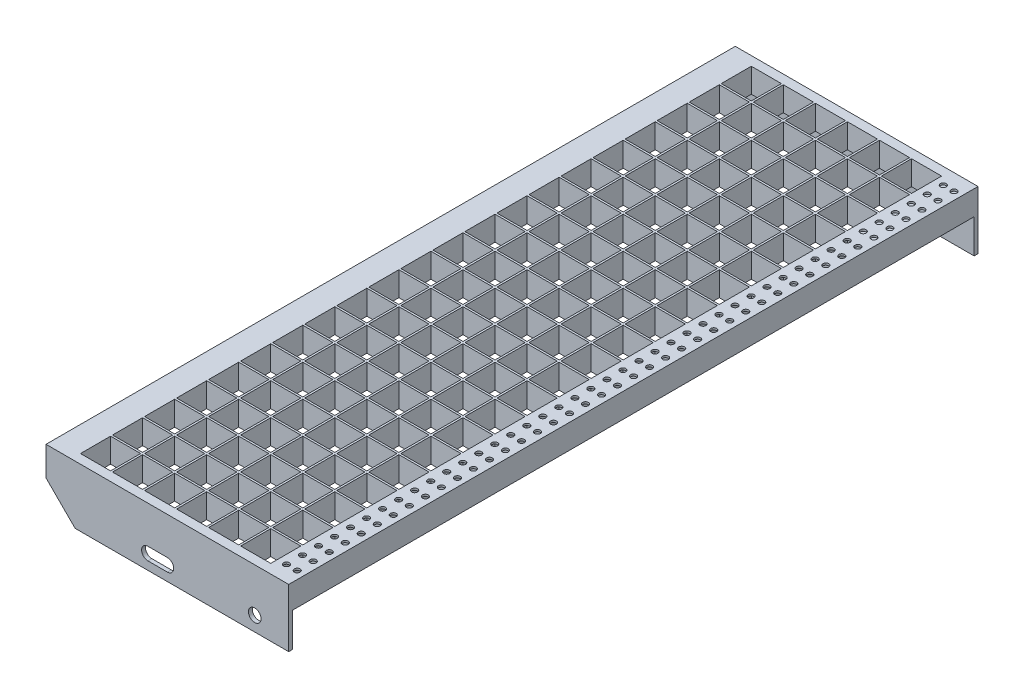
SolidWorks part; units mm, degrees
ref_plane "Vorne" through (0, 0, 0) normal (0, 0, 1) x (1, 0, 0)
ref_plane "Oben" through (0, 0, 0) normal (0, 1, 0) x (1, 0, 0)
ref_plane "Rechts" through (0, 0, 0) normal (1, 0, 0) x (0, 0, -1)
sketch "Skizze1" plane through (0, 0, 0) normal (0, 0, 1) x (1, 0, 0)
  line L1 (0, 0) -> (250, 0)
  line L2 (0, 0) -> (0, -25)
  line L3 (0, -25) -> (250, -25)
  line L4 (250, 0) -> (250, -25)
  dimension "D1" = 250
  dimension "D2" = 25
extrude "Basis-Linear austragen" add sketch "Skizze1" along normal mid plane 710
sketch "Skizze2" plane through (0, 0, 0) normal (0, 1, 0) x (-1, 0, 0)
  line L0 (-250, 355) -> (0, 355) construction
  line L1 (-222, 345.5) -> (-191, 345.5)
  line L2 (-222, 345.5) -> (-222, 314.5)
  line L3 (-222, 314.5) -> (-191, 314.5)
  line L4 (-191, 345.5) -> (-191, 314.5)
  line L5 (-250, 355) -> (-250, -355) construction
  dimension "D1" = 9.5
  dimension "D2" = 28
  dimension "D3" = 31
  dimension "D4" = 31
extrude "Schnitt-Linear austragen1" cut sketch "Skizze2" against normal through all
pattern_linear "Lineares Muster1" count 21 spacing 33 along (0, 0, -1) count 6 spacing 33 along (-1, 0, 0) of "Schnitt-Linear austragen1"
sketch "Skizze3" plane through (0, 0, 355) normal (0, 0, 1) x (1, 0, 0)
  line L0 (250, -60) -> (30, -60)
  line L1 (30, -60) -> (0, -30)
  line L2 (125, -38.5) -> (105, -38.5)
  line L3 (105, -51.5) -> (125, -51.5)
  line L4 (0, 0) -> (0, -25)
  line L5 (0, -25) -> (250, -25)
  line L6 (250, -25) -> (250, 0)
  line L7 (250, 0) -> (0, 0)
  line L8 (0, 0) -> (0, -30)
  line L10 (250, -60) -> (250, 0)
  line L11 (250, 0) -> (0, 0)
  circle A0 centre (215, -45) radius 6.5
  arc A1 (105, -38.5) -> (105, -51.5) centre (105, -45) ccw
  arc A2 (125, -51.5) -> (125, -38.5) centre (125, -45) ccw
  dimension "D5" = 13
  dimension "D2" = 60
  dimension "D3" = 30
  dimension "D4" = 30
  dimension "D6" = 13
  dimension "D7" = 90
  dimension "D8" = 20
  dimension "D9" = 35
  dimension "D10" = 15
  dimension "D1" = 0
extrude "Aufsatz-Linear austragen1" add sketch "Skizze3" against normal blind 4
mirror "Spiegeln1" about plane through (0, 0, 0) normal (0, 0, 1) of "Aufsatz-Linear austragen1"
sketch "Skizze4" plane through (0, -25, 0) normal (0, -1, 0) x (1, 0, 0)
  line L0 (222, 345.5) -> (191, 345.5) construction
  line L1 (224, 345.5) -> (246, 345.5)
  line L2 (224, 345.5) -> (224, 314.5)
  line L3 (224, 314.5) -> (246, 314.5)
  line L4 (246, 345.5) -> (246, 314.5)
  line L5 (222, 345.5) -> (222, 314.5) construction
  line L6 (222, 314.5) -> (191, 314.5) construction
  line L7 (250, 351) -> (250, -351) construction
  dimension "D1" = 2
  dimension "D2" = 4
extrude "Schnitt-Linear austragen2" cut sketch "Skizze4" against normal blind 23
pattern_linear "Lineares Muster2" count 18 spacing 33 along (0, 0, -1) of "Schnitt-Linear austragen2"
sketch "Skizze5" plane through (0, -2, 0) normal (0, -1, 0) x (1, 0, 0)
  line L0 (224, 314.5) -> (246, 314.5) construction
  line L1 (246, 314.5) -> (246, 345.5) construction
  circle A0 centre (242, 338.25) radius 3
  circle A1 centre (242, 321.75) radius 3
  dimension "D4" = 6
  dimension "D1" = 16.5
  dimension "D2" = 7.25
  dimension "D3" = 4
extrude "Schnitt-Linear austragen3" cut sketch "Skizze5" against normal blind 23
pattern_linear "Lineares Muster3" count 21 spacing 33 along (0, 0, -1) count 2 spacing 11 along (-1, 0, 0) of "Schnitt-Linear austragen3"
